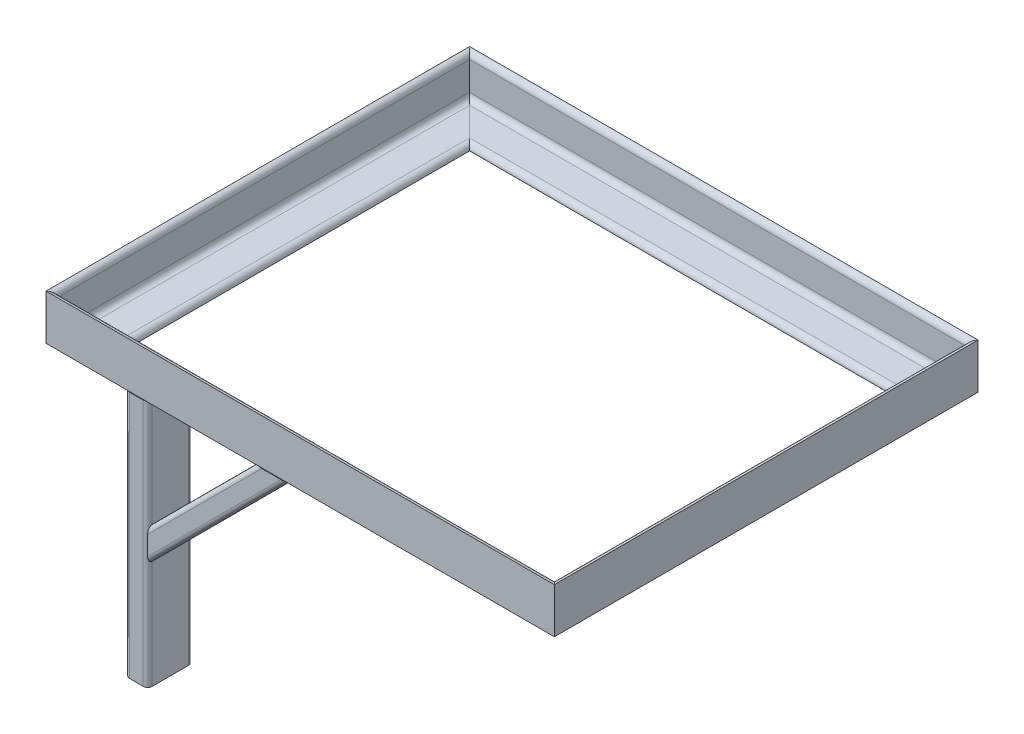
SolidWorks part; units mm, degrees
ref_plane "Front" through (0, 0, 0) normal (0, 0, 1) x (1, 0, 0)
ref_plane "Top" through (0, 0, 0) normal (0, 1, 0) x (1, 0, 0)
ref_plane "Right" through (0, 0, 0) normal (1, 0, 0) x (0, 0, -1)
ref_plane "Top of Frame" through (0, 500, 0) normal (0, 1, 0) x (-1, 0, 0)
ref_plane "Bottom of Legs" through (0, 20, 0) normal (0, 1, 0) x (-1, 0, 0)
sketch "Upper Frame" plane through (0, 500, 0) normal (0, 1, 0) x (-1, 0, 0)
  line L0 (-450, 375) -> (450, -375) construction
  line L1 (-450, -375) -> (450, -375)
  line L2 (-450, -375) -> (-450, 375)
  line L3 (-450, 375) -> (450, 375)
  line L4 (450, -375) -> (450, 375)
  dimension "D1" = 900
  dimension "D2" = 750
ref_plane "Front of Frame" through (0, 0, 375) normal (0, 0, 1) x (1, 0, 0)
sketch "Leg Sketch" plane through (0, 0, 375) normal (0, 0, 1) x (1, 0, 0)
  line L0 (0, 0) -> (0, 430.7934) construction
  line L1 (-290, 20) -> (-290, 500)
  line L2 (450, 500) -> (-450, 500) construction
  line L4 (-290, 220) -> (-10, 500)
  line L5 (50, 20) -> (-50, 20) construction
  line L6 (450, 500) -> (-450, 500) construction
  dimension "D1" = 580
  dimension "D2" = 200
  dimension "D3" = 45
other "L angle (equal) 80X80X10(2)"
ref_plane "Plane3" through (450, 500, 375) normal (-1, 0, 0) x (0, 1, 0)
sketch "Sketch1" plane through (450, 500, 375) normal (-1, 0, 0) x (0, 1, 0)
  line L0 (0, 80) -> (0, 0)
  line L2 (10, 70) -> (10, 20)
  line L3 (20, 10) -> (70, 10)
  line L5 (80, 0) -> (0, 0)
  arc A0 (10, 70) -> (0, 80) centre (0, 70) ccw
  arc A1 (80, 0) -> (70, 10) centre (70, 0) ccw
  arc A2 (20, 10) -> (10, 20) centre (20, 20) cw
  point P8 (0, 40)
  point P9 (40, 0)
  point P10 (0, 0)
  dimension "Radius_2" = 10
  dimension "Radius_1" = 10
  dimension "V_leg" = 80
  dimension "H_leg" = 80
  dimension "thickness" = 10
other "Tube (rectangular) 80 X 40 X 4.0(1)"
ref_plane "Plane4" through (-290, 20, 375) normal (0, 1, 0) x (-1, 0, 0)
sketch "Sketch17" plane through (-290, 20, 375) normal (0, 1, 0) x (-1, 0, 0)
  line L0 (-12, -36) -> (12, -36)
  line L1 (-16, -32) -> (-16, 32)
  line L2 (12, 36) -> (-12, 36)
  line L3 (16, 32) -> (16, -32)
  line L4 (-12, -40) -> (12, -40)
  line L5 (-20, -32) -> (-20, 32)
  line L6 (12, 40) -> (-12, 40)
  line L7 (20, 32) -> (20, -32)
  line L8 (-20, 0) -> (-16, 0) construction
  line L9 (-16, 0) -> (16, 0) construction
  line L10 (16, 0) -> (20, 0) construction
  line L11 (0, 40) -> (0, 36) construction
  line L12 (0, 36) -> (0, -36) construction
  line L13 (0, -36) -> (0, -40) construction
  arc A0 (20, 32) -> (12, 40) centre (12, 32) ccw
  arc A1 (12, -40) -> (20, -32) centre (12, -32) ccw
  arc A2 (-20, -32) -> (-12, -40) centre (-12, -32) ccw
  arc A3 (-12, 40) -> (-20, 32) centre (-12, 32) ccw
  arc A4 (-12, 36) -> (-16, 32) centre (-12, 32) ccw
  arc A5 (16, 32) -> (12, 36) centre (12, 32) ccw
  arc A6 (12, -36) -> (16, -32) centre (12, -32) ccw
  arc A7 (-16, -32) -> (-12, -36) centre (-12, -32) ccw
  point P6 (-20, 40)
  point P33 (-20, -40)
  point P34 (20, -40)
  point P36 (20, 40)
  point P37 (0, 0)
  dimension "D1" = 8
  dimension "Thickness" = 4
  dimension "V_leg" = 80
  dimension "H_leg" = 40
other "Trim/Extend1"
